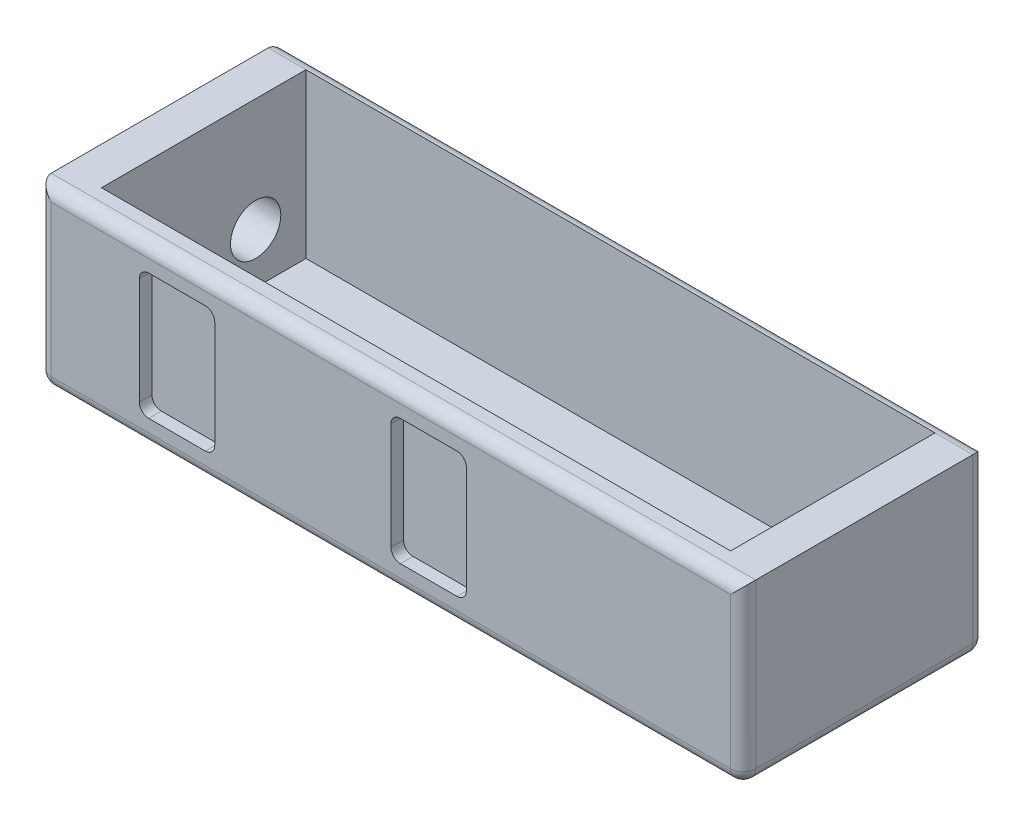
SolidWorks part; units mm, degrees
ref_plane "Front Plane" through (0, 0, 0) normal (0, 0, 1) x (1, 0, 0)
ref_plane "Top Plane" through (0, 0, 0) normal (0, 1, 0) x (1, 0, 0)
ref_plane "Right Plane" through (0, 0, 0) normal (1, 0, 0) x (0, 0, -1)
sketch "Sketch1" plane through (0, 0, 0) normal (0, 1, 0) x (1, 0, 0)
  line L1 (-177.8, 61.1187) -> (177.8, 61.1187)
  line L2 (-177.8, 61.1187) -> (-177.8, -61.1188)
  line L3 (-177.8, -61.1188) -> (177.8, -61.1188)
  line L4 (177.8, 61.1187) -> (177.8, -61.1188)
  line L5 (-177.8, 61.1187) -> (177.8, -61.1188) construction
  line L6 (-177.8, -61.1188) -> (177.8, 61.1187) construction
  point P0 (0, 0)
  dimension "D1" = 122.2375
  dimension "D2" = 355.6
extrude "Boss-Extrude1" add sketch "Sketch1" along normal blind 6.35
sketch "Sketch2" plane through (0, 6.35, 0) normal (0, 1, 0) x (1, 0, 0)
  line L1 (-177.8, 61.1188) -> (177.8, 61.1188)
  line L2 (-177.8, 61.1188) -> (-177.8, -61.1188)
  line L3 (-177.8, -61.1188) -> (177.8, -61.1188)
  line L4 (177.8, 61.1188) -> (177.8, -61.1188)
  line L5 (-177.8, 61.1188) -> (177.8, -61.1188) construction
  line L6 (-177.8, -61.1188) -> (177.8, 61.1188) construction
  line L7 (-158.75, 54.7688) -> (158.75, 54.7688)
  line L8 (-158.75, 54.7688) -> (-158.75, -48.4188)
  line L9 (-158.75, -48.4188) -> (158.75, -48.4188)
  line L10 (158.75, 54.7688) -> (158.75, -48.4188)
  point P0 (0, 0)
  point P7 (0, 0)
  dimension "D1" = 19.05
  dimension "D2" = 19.05
  dimension "D3" = 6.35
  dimension "D4" = 12.7
extrude "Boss-Extrude2" add sketch "Sketch2" along normal blind 82.55
fillet "Fillet1" radius 6.35 2 edges at (0, 88.9, -61.1188) (0, 88.9, 61.1188)
sketch "Sketch3" plane through (-177.8, 0, 0) normal (-1, 0, 0) x (0, 0, 1)
  line L0 (-61.1187, 0) -> (61.1188, 0) construction
  line L1 (-61.1187, 82.55) -> (-61.1187, 0) construction
  circle A0 centre (-29.3688, 31.75) radius 12.7
  dimension "D1" = 25.4
  dimension "D2" = 31.75
  dimension "D3" = 31.75
extrude "Cut-Extrude1" cut sketch "Sketch3" against normal up to next
fillet "Fillet2" radius 6.35 8 edges at (-177.8, 41.275, -61.1187) (0, 0, -61.1187) (177.8, 41.275, -61.1187) (177.8, 0, 0) (177.8, 41.275, 61.1188) (-177.8, 0, 0) (0, 0, 61.1188) (-177.8, 41.275, 61.1188)
sketch "Sketch4" plane through (0, 0, 61.1188) normal (0, 0, 1) x (1, 0, 0)
  line L0 (-177.8, 88.9) -> (177.8, 88.9) construction
  line L1 (-122.2375, 76.2) -> (-93.6625, 76.2)
  line L2 (-127, 71.4375) -> (-127, 17.4625)
  line L3 (-122.2375, 12.7) -> (-93.6625, 12.7)
  line L4 (-88.9, 71.4375) -> (-88.9, 17.4625)
  line L5 (-177.8, 6.35) -> (-177.8, 88.9) construction
  line L6 (4.7625, 12.7) -> (33.3375, 12.7)
  line L7 (38.1, 71.4375) -> (38.1, 17.4625)
  line L8 (0, 71.4375) -> (0, 17.4625)
  line L9 (4.7625, 76.2) -> (33.3375, 76.2)
  arc A0 (-93.6625, 12.7) -> (-88.9, 17.4625) centre (-93.6625, 17.4625) ccw
  arc A1 (-127, 17.4625) -> (-122.2375, 12.7) centre (-122.2375, 17.4625) ccw
  arc A2 (-93.6625, 76.2) -> (-88.9, 71.4375) centre (-93.6625, 71.4375) cw
  arc A3 (-122.2375, 76.2) -> (-127, 71.4375) centre (-122.2375, 71.4375) ccw
  arc A4 (33.3375, 76.2) -> (38.1, 71.4375) centre (33.3375, 71.4375) cw
  arc A5 (4.7625, 76.2) -> (0, 71.4375) centre (4.7625, 71.4375) ccw
  arc A6 (33.3375, 12.7) -> (38.1, 17.4625) centre (33.3375, 17.4625) ccw
  arc A7 (0, 17.4625) -> (4.7625, 12.7) centre (4.7625, 17.4625) ccw
  dimension "D5" = 4.7625
  dimension "D6" = 4.7625
  dimension "D1" = 12.7
  dimension "D2" = 50.8
  dimension "D3" = 38.1
  dimension "D4" = 63.5
extrude "Cut-Extrude2" cut sketch "Sketch4" against normal blind 6.35
sketch "Sketch5" plane through (0, 88.9, 0) normal (0, 1, 0) x (1, 0, 0)
  line L0 (-158.75, -48.4188) -> (-177.8, -48.4188)
  line L1 (-177.8, 54.7687) -> (-177.8, -54.7687) construction
  line L2 (158.75, -48.4188) -> (177.8, -48.4188)
  line L3 (177.8, -54.7687) -> (177.8, 54.7687) construction
sketch "Sketch6" plane through (177.8, 0, 0) normal (1, 0, 0) x (0, 0, -1)
  line L0 (-48.4227, 88.8808) -> (-48.4227, 0)
  line L1 (54.7687, 0) -> (-54.7688, 0) construction
sketch "Sketch7" plane through (-177.8, 0, 0) normal (-1, 0, 0) x (0, 0, 1)
  line L0 (48.4227, 88.8808) -> (48.4227, 0)
